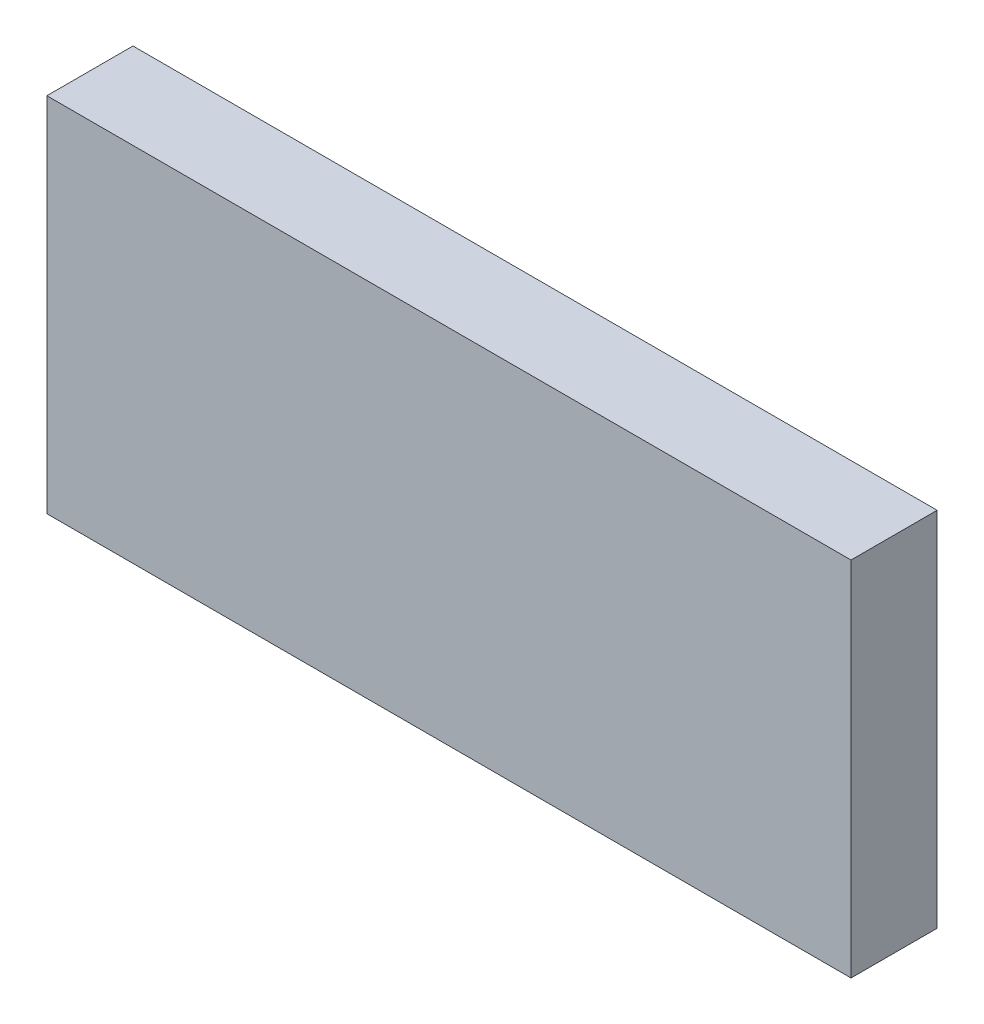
SolidWorks part; units mm, degrees
ref_plane "Front Plane" through (0, 0, 0) normal (0, 0, 1) x (1, 0, 0)
ref_plane "Top Plane" through (0, 0, 0) normal (0, 1, 0) x (1, 0, 0)
ref_plane "Right Plane" through (0, 0, 0) normal (1, 0, 0) x (0, 0, -1)
sketch "Sketch1" plane through (0, 0, 0) normal (0, 0, 1) x (1, 0, 0)
  line L1 (-52.1797, 23.4886) -> (52.1797, 23.4886)
  line L2 (-52.1797, 23.4886) -> (-52.1797, -23.4886)
  line L3 (-52.1797, -23.4886) -> (52.1797, -23.4886)
  line L4 (52.1797, 23.4886) -> (52.1797, -23.4886)
  line L5 (-52.1797, 23.4886) -> (52.1797, -23.4886) construction
  line L6 (-52.1797, -23.4886) -> (52.1797, 23.4886) construction
  point P0 (0, 0)
sketch "Sketch2" plane through (0, 0, 0) normal (0, 0, 1) x (1, 0, 0)
  line L0 (-52.1797, 23.4886) -> (52.1797, 23.4886)
  line L1 (-52.1797, 23.4886) -> (-52.1797, -23.4886)
  line L2 (-52.1797, -23.4886) -> (52.1797, -23.4886)
  line L3 (52.1797, 23.4886) -> (52.1797, -23.4886)
  line L4 (-52.1797, 23.4886) -> (52.1797, -23.4886) construction
  line L5 (-52.1797, -23.4886) -> (52.1797, 23.4886) construction
  point P0 (0, 0)
extrude "Extrude1" add sketch "Sketch2" along normal blind 11.176
